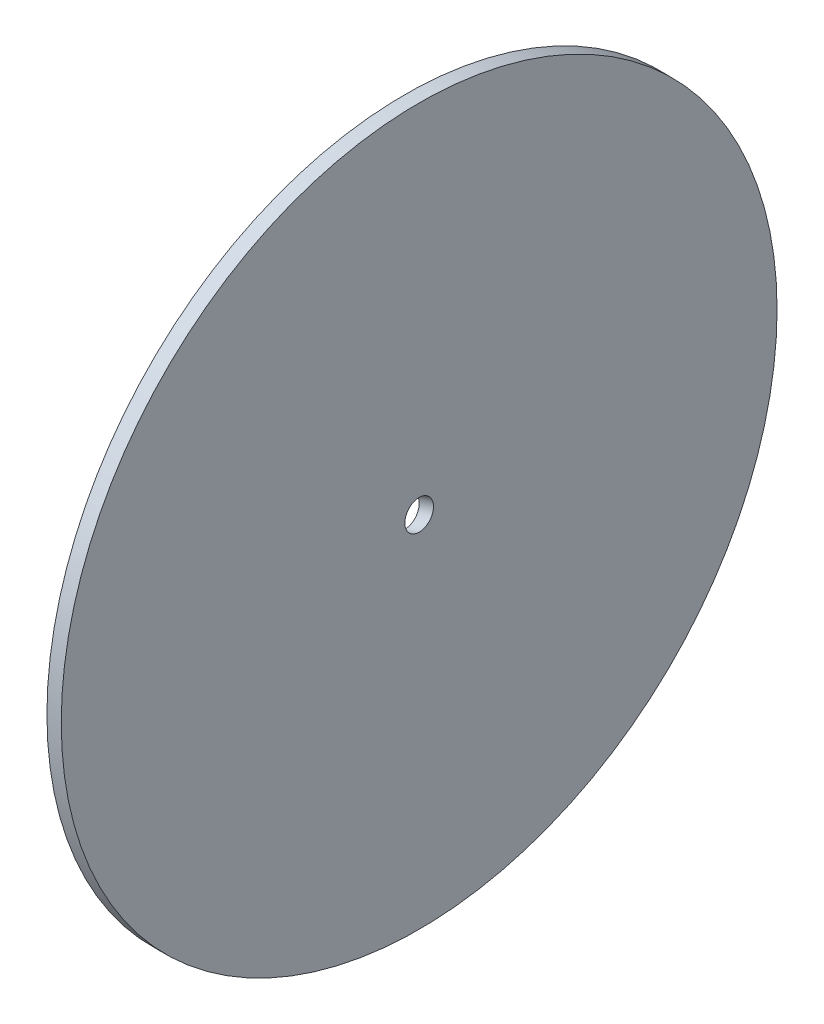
SolidWorks part; units mm, degrees
ref_plane "Front Plane" through (0, 0, 0) normal (0, 0, 1) x (1, 0, 0)
ref_plane "Top Plane" through (0, 0, 0) normal (0, 1, 0) x (1, 0, 0)
ref_plane "Right Plane" through (0, 0, 0) normal (1, 0, 0) x (0, 0, -1)
sketch "Sketch1" plane through (0, 0, 0) normal (1, 0, 0) x (0, 0, -1)
  circle A0 centre (0, 0) radius 50
  dimension "D1" = 100
extrude "Boss-Extrude1" add sketch "Sketch1" along normal blind 2
sketch "Sketch2" plane through (0, 0, 0) normal (0, 0, 1) x (1, 0, 0)
  line L1 (-20.4048, -7.1173) -> (23.4048, 7.1173)
  point P7 (1.5, 0)
sweep "Cut-Sweep1" cut path "Sketch2" parameters "D3"=4
